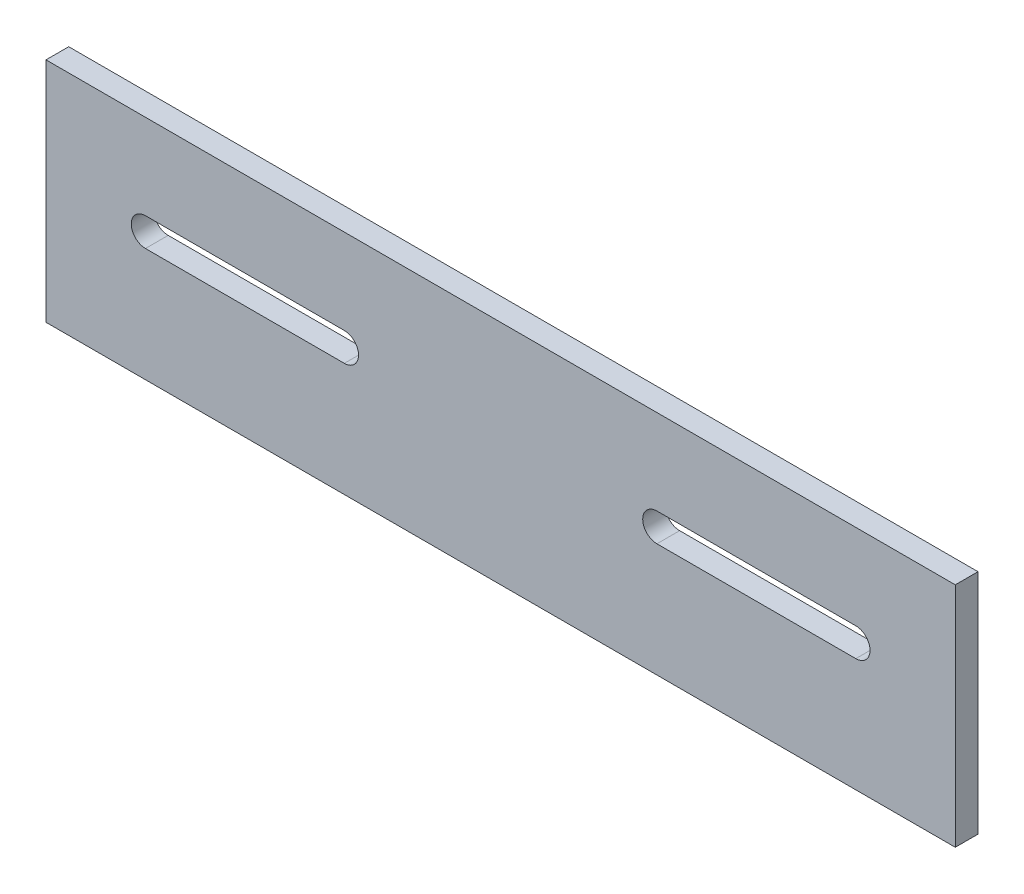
SolidWorks part; units mm, degrees
ref_plane "前视基准面" through (0, 0, 0) normal (0, 0, 1) x (1, 0, 0)
ref_plane "上视基准面" through (0, 0, 0) normal (0, 1, 0) x (1, 0, 0)
ref_plane "右视基准面" through (0, 0, 0) normal (1, 0, 0) x (0, 0, -1)
sketch "草图1" plane through (0, 0, 0) normal (0, 0, 1) x (1, 0, 0)
  line L1 (-160, 40) -> (160, 40)
  line L2 (-160, 40) -> (-160, -40)
  line L3 (-160, -40) -> (160, -40)
  line L4 (160, 40) -> (160, -40)
  dimension "D1" = 320
  dimension "D2" = 80
  dimension "D3" = 40
  dimension "D4" = 160
extrude "拉伸1" add sketch "草图1" along normal blind 8
sketch "草图2" plane through (0, 0, 8) normal (0, 0, 1) x (1, 0, 0)
  line L0 (-188.3101, 5) -> (183.2936, 5) construction
  line L1 (160, 40) -> (-160, 40) construction
  line L2 (-160, 40) -> (-160, -40) construction
  line L4 (-125, 10) -> (-55, 10)
  line L5 (-125, 0) -> (-55, 0)
  line L6 (55, 10) -> (125, 10)
  line L7 (55, 0) -> (125, 0)
  arc A0 (-125, 10) -> (-125, 0) centre (-125, 5) ccw
  arc A1 (-55, 0) -> (-55, 10) centre (-55, 5) ccw
  arc A2 (55, 10) -> (55, 0) centre (55, 5) ccw
  arc A3 (125, 0) -> (125, 10) centre (125, 5) ccw
  dimension "D2" = 10
  dimension "D3" = 10
  dimension "D4" = 10
  dimension "D5" = 10
  dimension "D6" = 35
  dimension "D7" = 70
  dimension "D8" = 110
  dimension "D9" = 70
  dimension "D1" = 35
extrude "切除-拉伸1" cut sketch "草图2" against normal blind 8
